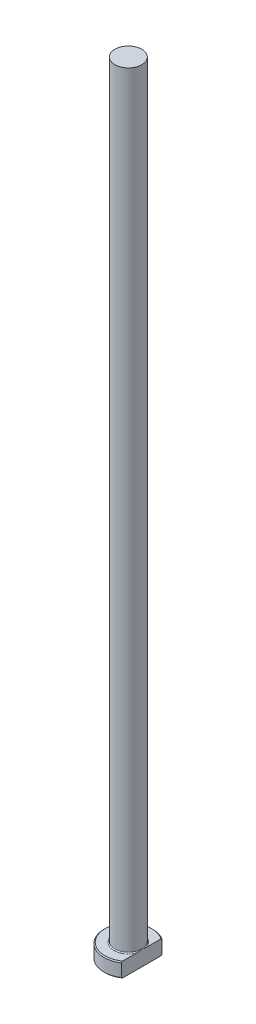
SolidWorks part; units mm, degrees
ref_plane "Front Plane" through (0, 0, 0) normal (0, 0, 1) x (1, 0, 0)
ref_plane "Top Plane" through (0, 0, 0) normal (0, 1, 0) x (1, 0, 0)
ref_plane "Right Plane" through (0, 0, 0) normal (1, 0, 0) x (0, 0, -1)
sketch "Sketch1" plane through (0, 0, 0) normal (0, 0, 1) x (1, 0, 0)
  line L0 (0, 259.9588) -> (0, -15.1925) construction
  line L1 (0, 0) -> (-5, 0)
  line L2 (-5, 0) -> (-5, 3)
  line L3 (-5, 3) -> (-2.75, 3)
  line L4 (-2.75, 3) -> (-2.75, 160)
  line L5 (-2.75, 160) -> (0, 160)
  line L6 (0, 160) -> (0, 0)
  dimension "L" = 160
  dimension "H" = 10
  dimension "T" = 3
  dimension "D" = 5.5
revolve "Revolve1" add sketch "Sketch1" angle 360 about L0
chamfer "Chamfer1" distance 0.2 angle 45 2 edges at (0, 3, 5) (0, 0, 5)
fillet "Fillet1" radius 0.2 1 edges at (0, 3, 2.75)
sketch "Sketch2" plane through (0, 0, 0) normal (0, 1, 0) x (1, 0, 0)
  line L0 (2.75, 4.1758) -> (2.75, -4.1758)
  circle A0 centre (0, 0) radius 5 construction
  arc A1 (2.75, -4.1758) -> (2.75, 4.1758) centre (0, 0) ccw
  circle A2 centre (0, 0) radius 2.75 construction
extrude "KEY" cut sketch "Sketch2" along normal through all
